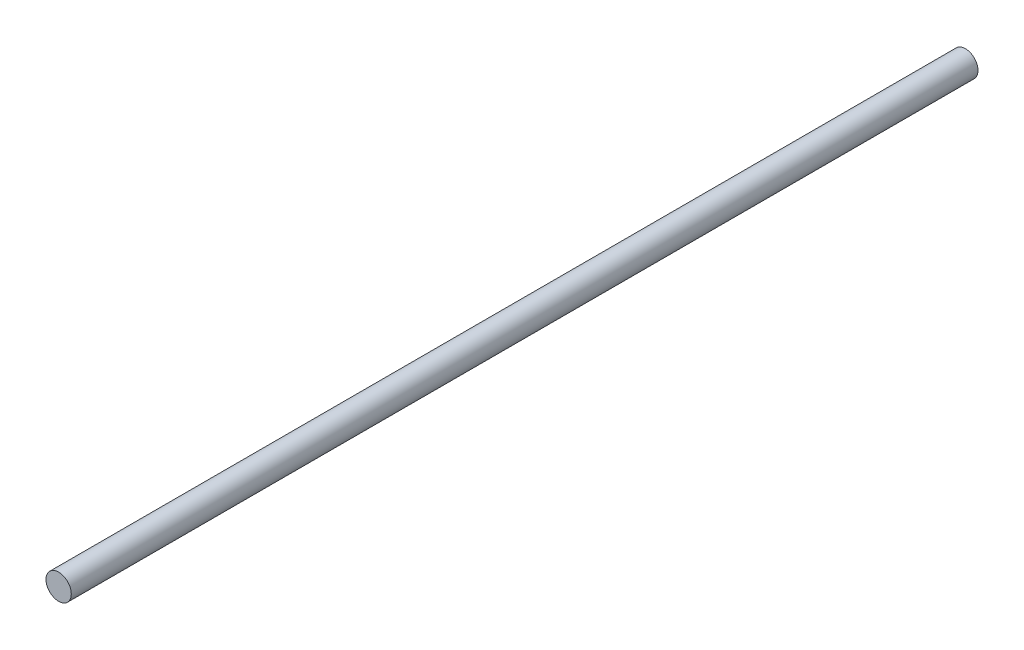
SolidWorks part; units mm, degrees
ref_plane "Front Plane" through (0, 0, 0) normal (0, 0, 1) x (1, 0, 0)
ref_plane "Top Plane" through (0, 0, 0) normal (0, 1, 0) x (1, 0, 0)
ref_plane "Right Plane" through (0, 0, 0) normal (1, 0, 0) x (0, 0, -1)
sketch "Sketch1" plane through (0, 0, 0) normal (0, 0, 1) x (1, 0, 0)
  circle A0 centre (0, 0) radius 30
  dimension "D1" = 60
extrude "Boss-Extrude1" add sketch "Sketch1" against normal blind 2150
